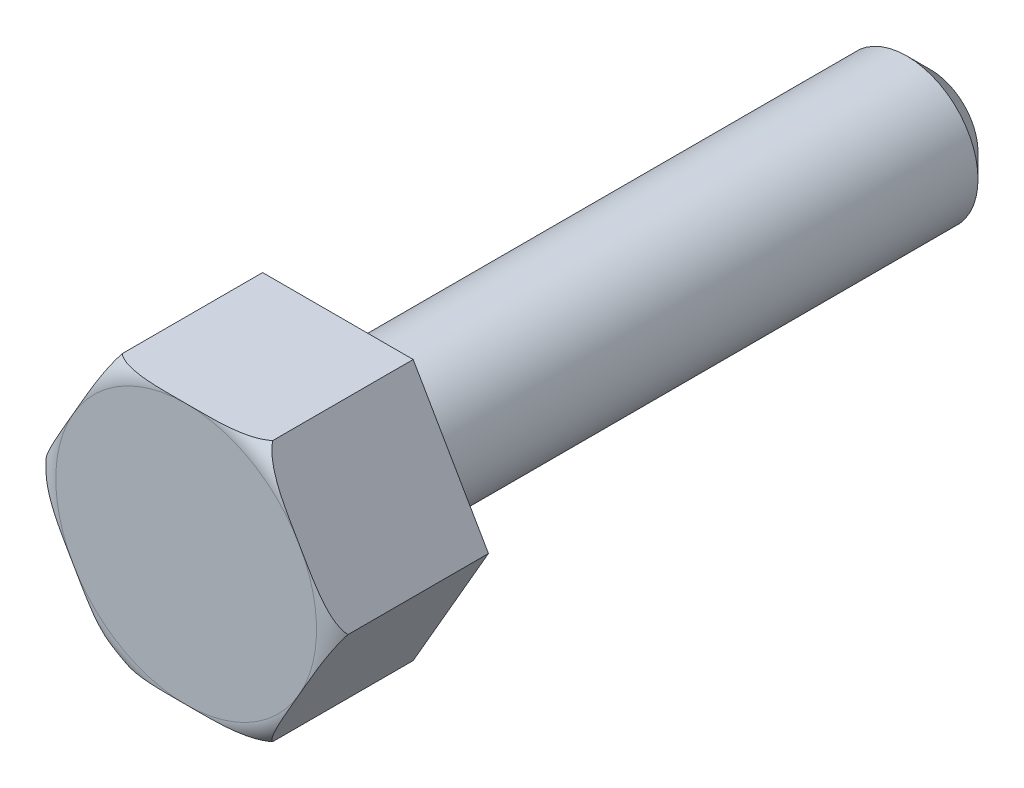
SolidWorks part; units mm, degrees
ref_plane "Plan1" through (0, 0, 0) normal (0, 0, 1) x (1, 0, 0)
ref_plane "Plan2" through (0, 0, 0) normal (0, 1, 0) x (1, 0, 0)
ref_plane "Plan3" through (0, 0, 0) normal (1, 0, 0) x (0, 0, -1)
sketch "Esquisse1" plane through (0, 0, 0) normal (0, 0, 1) x (1, 0, 0)
  circle A0 centre (0, 0) radius 6.5
  dimension "D1" = 13
extrude "Extrusion1" add sketch "Esquisse1" along normal blind 6.4
fillet "Congé1" radius 1
sketch "Esquisse2" plane through (0, 0, 6.4) normal (0, 0, 1) x (1, 0, 0)
  line L1 (6.3509, 0) -> (3.1754, 5.5)
  line L2 (3.1754, 5.5) -> (-3.1754, 5.5)
  line L3 (-3.1754, 5.5) -> (-6.3509, 0)
  line L4 (-6.3509, 0) -> (-3.1754, -5.5)
  line L5 (-3.1754, -5.5) -> (3.1754, -5.5)
  line L6 (3.1754, -5.5) -> (6.3509, 0)
  circle A0 centre (0, 0) radius 5.5 construction
  circle A1 centre (0, 0) radius 14.1421
  dimension "D1" = 11
extrude "Enlèv. mat.-Extru.1" cut sketch "Esquisse2" against normal through all
sketch "Esquisse3" plane through (0, 0, 0) normal (0, 0, -1) x (-1, 0, 0)
  circle A0 centre (0, 0) radius 3
  dimension "D1" = 6
extrude "Extrusion2" add sketch "Esquisse3" along normal blind 25
chamfer "Chanfrein1" distance 1 angle 45
